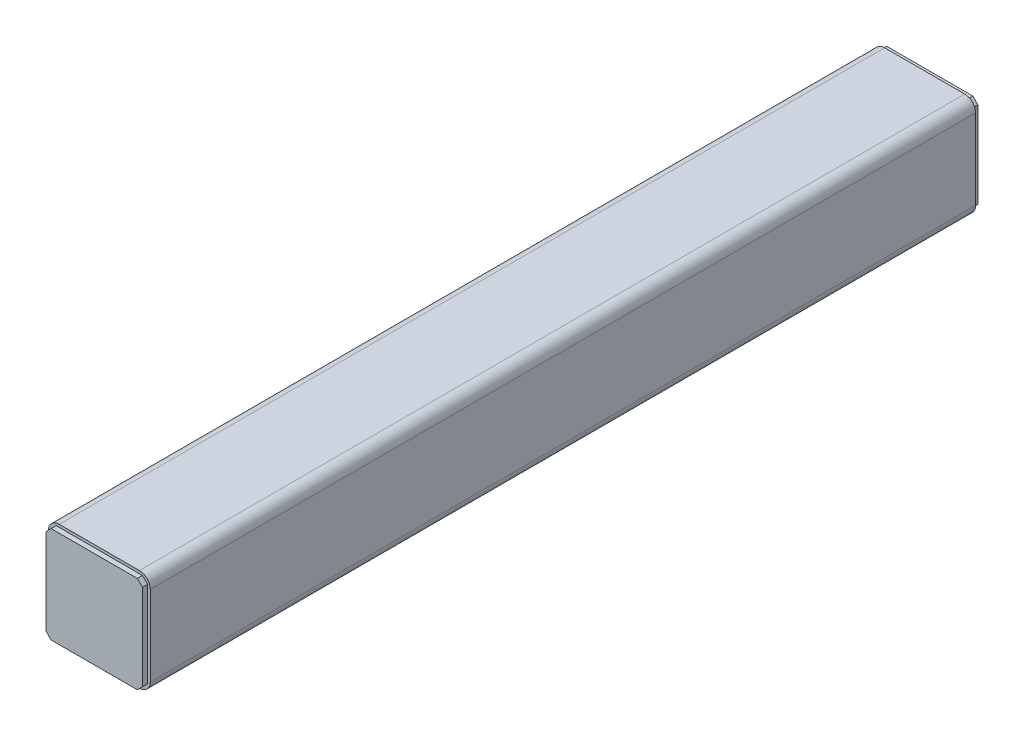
SolidWorks part; units mm, degrees
ref_plane "Plan de face" through (0, 0, 0) normal (0, 0, 1) x (1, 0, 0)
ref_plane "Plan de dessus" through (0, 0, 0) normal (0, 1, 0) x (1, 0, 0)
ref_plane "Plan de droite" through (0, 0, 0) normal (1, 0, 0) x (0, 0, -1)
sketch "Esquisse1" plane through (0, 0, 0) normal (1, 0, 0) x (0, 0, -1)
  line L0 (0, 0) -> (492, 0)
  dimension "D1" = 492
other "Elément mécano-soudé1"
ref_plane "Plan1" through (0, 0, 0) normal (0, 0, -1) x (0, 1, 0)
sketch "Sketch11" plane through (0, 0, 0) normal (0, 0, -1) x (0, 1, 0)
  line L0 (-23.6, -26.8) -> (23.6, -26.8)
  line L1 (-26.8, -23.6) -> (-26.8, 23.6)
  line L2 (23.6, 26.8) -> (-23.6, 26.8)
  line L3 (26.8, 23.6) -> (26.8, -23.6)
  line L4 (-23.6, -30) -> (23.6, -30)
  line L5 (-30, -23.6) -> (-30, 23.6)
  line L6 (23.6, 30) -> (-23.6, 30)
  line L7 (30, 23.6) -> (30, -23.6)
  line L8 (-30, 0) -> (-26.8, 0) construction
  line L9 (-26.8, 0) -> (26.8, 0) construction
  line L10 (26.8, 0) -> (30, 0) construction
  line L12 (0, 30) -> (0, 26.8) construction
  line L13 (0, 26.8) -> (0, -26.8) construction
  line L14 (0, -26.8) -> (0, -30) construction
  arc A0 (30, 23.6) -> (23.6, 30) centre (23.6, 23.6) ccw
  arc A1 (23.6, -30) -> (30, -23.6) centre (23.6, -23.6) ccw
  arc A2 (-30, -23.6) -> (-23.6, -30) centre (-23.6, -23.6) ccw
  arc A3 (-23.6, 30) -> (-30, 23.6) centre (-23.6, 23.6) ccw
  arc A4 (-23.6, 26.8) -> (-26.8, 23.6) centre (-23.6, 23.6) ccw
  arc A5 (26.8, 23.6) -> (23.6, 26.8) centre (23.6, 23.6) ccw
  arc A6 (23.6, -26.8) -> (26.8, -23.6) centre (23.6, -23.6) ccw
  arc A7 (-26.8, -23.6) -> (-23.6, -26.8) centre (-23.6, -23.6) ccw
  point P2 (-30, 30)
  point P33 (-30, -30)
  point P34 (30, -30)
  point P36 (30, 30)
  point P37 (0, 0)
  dimension "D1" = 6.4
  dimension "Thickness" = 3.2
  dimension "V_leg" = 60
  dimension "H_leg" = 60
other "Embout1" parameters "D1"=3, "D2"=3, "D3"=3
ref_plane "Plan2" through (0, 0, 0) normal (-1, 0, 0) x (0, 0, 1)
